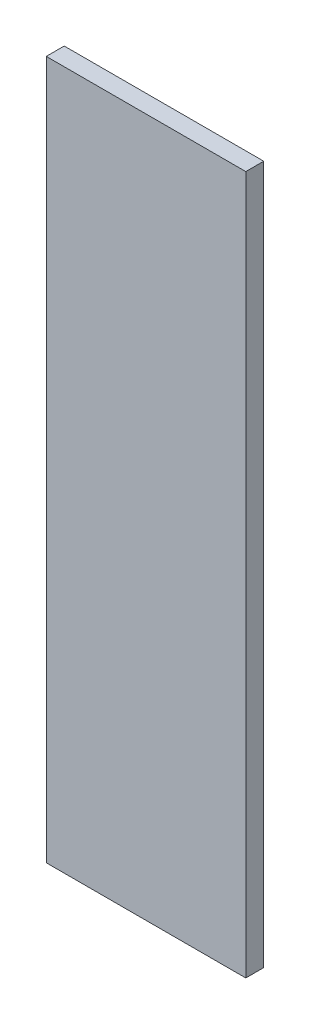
SolidWorks part; units mm, degrees
ref_plane "Front Plane" through (0, 0, 0) normal (0, 0, 1) x (1, 0, 0)
ref_plane "Top Plane" through (0, 0, 0) normal (0, 1, 0) x (1, 0, 0)
ref_plane "Right Plane" through (0, 0, 0) normal (1, 0, 0) x (0, 0, -1)
sketch "Sketch1" plane through (0, 0, 0) normal (0, 0, 1) x (1, 0, 0)
  line L1 (-100, 350) -> (100, 350)
  line L2 (-100, 350) -> (-100, -350)
  line L3 (-100, -350) -> (100, -350)
  line L4 (100, 350) -> (100, -350)
  line L5 (-100, 350) -> (100, -350) construction
  line L6 (-100, -350) -> (100, 350) construction
  point P0 (0, 0)
  dimension "D1" = 200
  dimension "D2" = 700
extrude "Boss-Extrude1" add sketch "Sketch1" along normal blind 18
